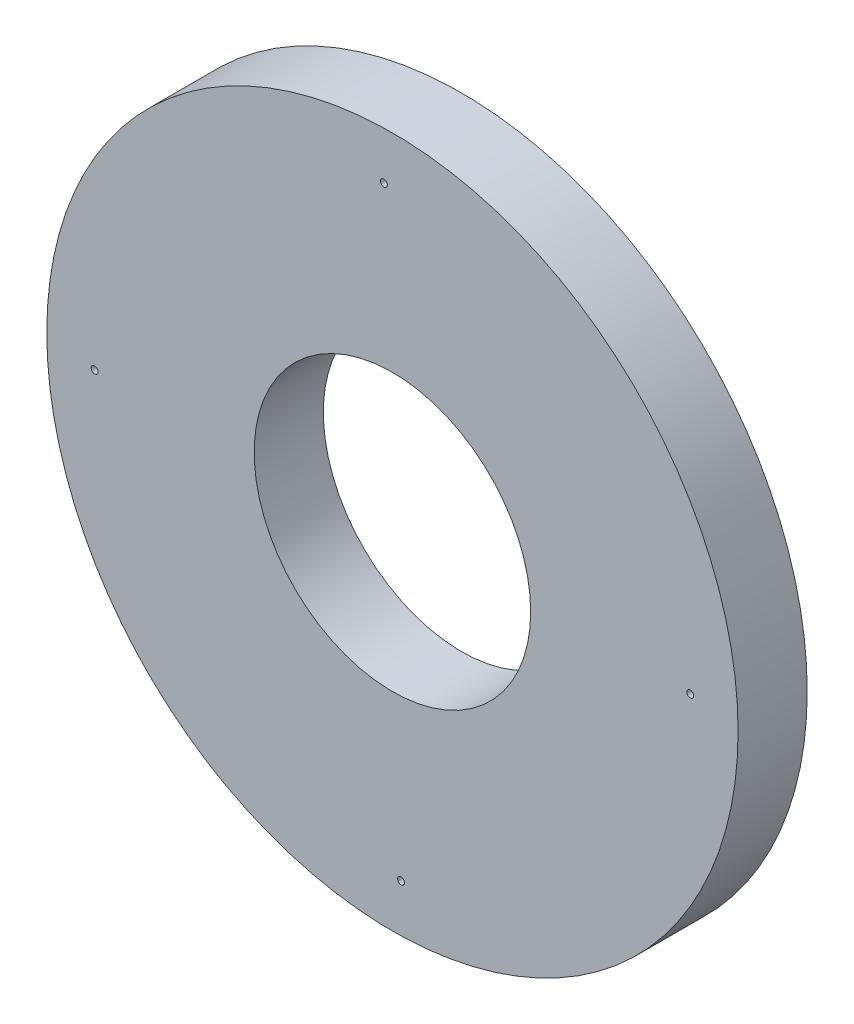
SolidWorks part; units mm, degrees
ref_plane "Front Plane" through (0, 0, 0) normal (0, 0, 1) x (1, 0, 0)
ref_plane "Top Plane" through (0, 0, 0) normal (0, 1, 0) x (1, 0, 0)
ref_plane "Right Plane" through (0, 0, 0) normal (1, 0, 0) x (0, 0, -1)
sketch "Sketch1" plane through (0, 0, 0) normal (0, 0, 1) x (1, 0, 0)
  line L1 (-8.3681, 3.175) -> (-7.4531, -28.5618) construction
  circle A0 centre (-8.3681, 3.175) radius 31.75
  circle A1 centre (-8.3681, 3.175) radius 12.7
  circle A2 centre (-35.7252, 2.3862) radius 0.3175
  circle A3 centre (-7.5793, -24.1821) radius 0.3175
  circle A4 centre (-9.1568, 30.5321) radius 0.3175
  circle A5 centre (18.9891, 3.9638) radius 0.3175
  dimension "D1" = 63.5
  dimension "D4" = 4
  dimension "D2" = 25.4
  dimension "D3" = 4.3797
  dimension "D5" = 0.635
extrude "Boss-Extrude1" add sketch "Sketch1" along normal blind 6.35
